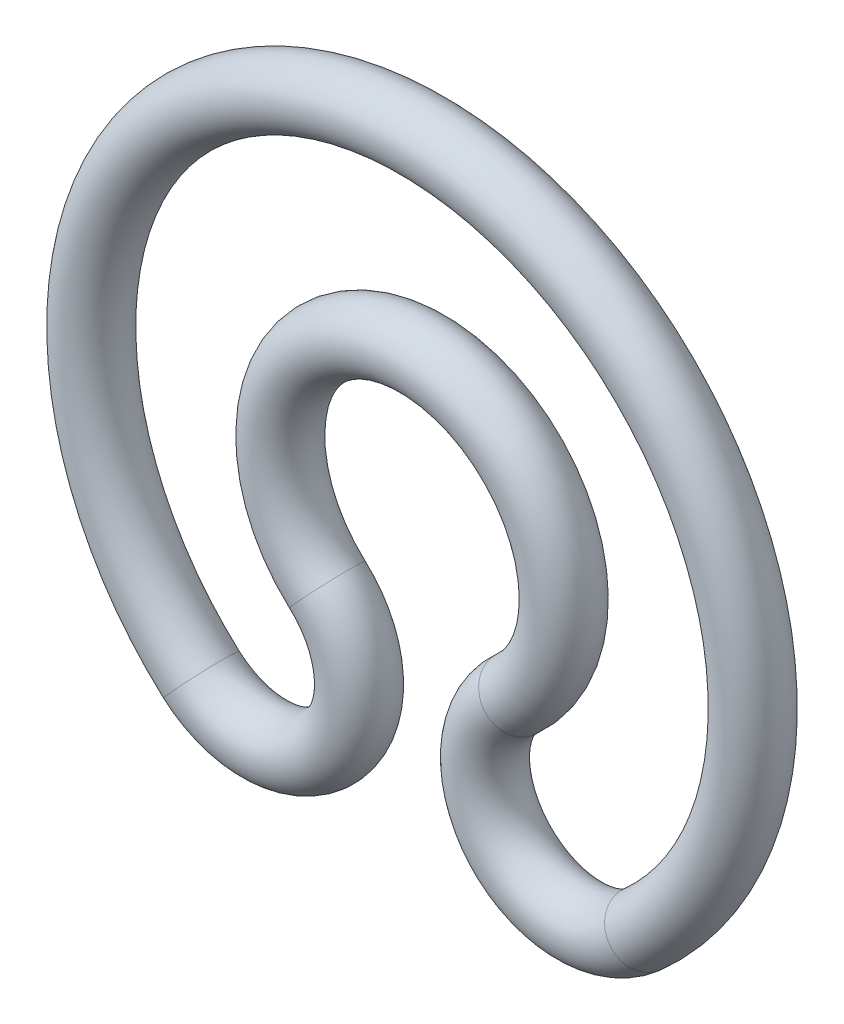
SolidWorks part; units mm, degrees
ref_plane "Face" through (0, 0, 0) normal (0, 0, 1) x (1, 0, 0)
ref_plane "Dessus" through (0, 0, 0) normal (0, 1, 0) x (1, 0, 0)
ref_plane "Droite" through (0, 0, 0) normal (1, 0, 0) x (0, 0, -1)
sketch "Esquisse1" plane through (0, 0, 0) normal (0, 0, 1) x (1, 0, 0)
  line L0 (0, 0) -> (1.5, -1.6771) construction
  line L1 (0, 0) -> (-1.5, -1.6771) construction
  arc A0 (1.5, -1.6771) -> (-1.5, -1.6771) centre (0, 0) ccw
  arc A1 (3.5, -3.9131) -> (-3.5, -3.9131) centre (0, 0) ccw
  arc A2 (1.5, -1.6771) -> (3.5, -3.9131) centre (2.5, -2.7951) ccw
  arc A3 (-1.5, -1.6771) -> (-3.5, -3.9131) centre (-2.5, -2.7951) cw
  dimension "D1" = 4.5
  dimension "D2" = 10.5
  dimension "D3" = 3
  dimension "D4" = 1.5
  dimension "D5" = 7
  dimension "D6" = 3.5
sketch "Esquisse2" plane through (0, 0, 0) normal (0, 1, 0) x (1, 0, 0)
  line L2 (-2.25, 0) -> (2.25, 0) construction
  circle A0 centre (2.25, 0) radius 0.5
  dimension "D1" = 1
sweep "Balayage1" add profiles "Esquisse2" path "Esquisse1"
ref_plane "Plan1" through (0, 0, 0.5) normal (0, 0, 1) x (1, 0, 0)
